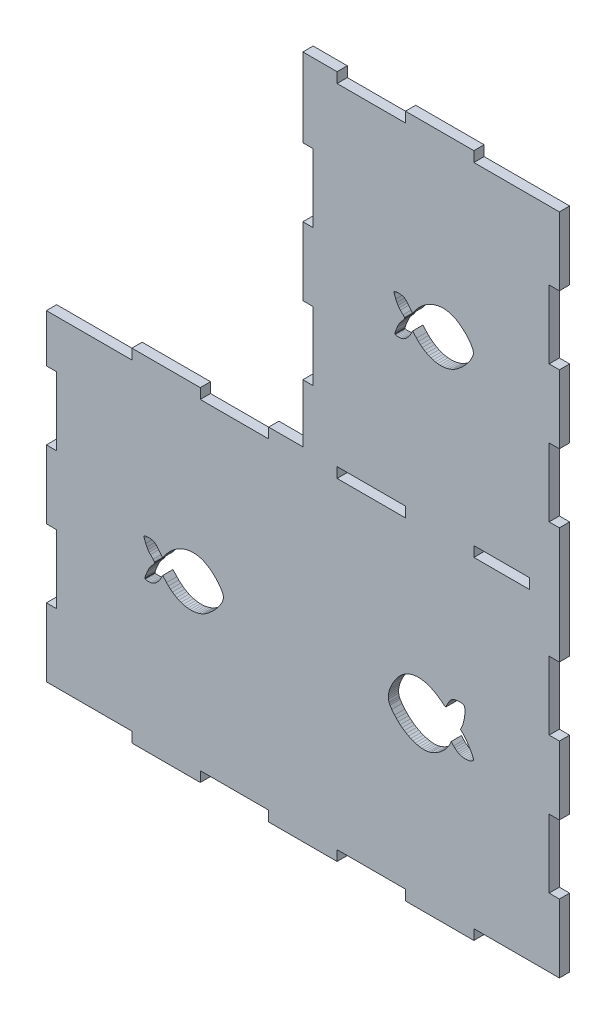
SolidWorks part; units mm, degrees
ref_plane "Alzado" through (0, 0, 0) normal (0, 0, 1) x (1, 0, 0)
ref_plane "Planta" through (0, 0, 0) normal (0, 1, 0) x (1, 0, 0)
ref_plane "Vista lateral" through (0, 0, 0) normal (1, 0, 0) x (0, 0, -1)
sketch "Sketch1" plane through (0, 0, 0) normal (0, 0, 1) x (1, 0, 0)
  line L1 (0, 0) -> (600, 0)
  line L2 (0, 0) -> (0, 400)
  line L3 (0, 400) -> (300, 400)
  line L4 (600, 0) -> (600, 400)
  line L6 (600, 400) -> (600, 800)
  line L7 (600, 800) -> (300, 800)
  line L8 (300, 400) -> (300, 800)
  dimension "D1" = 600
  dimension "D2" = 300
  dimension "D3" = 400
  dimension "D4" = 400
  dimension "D5" = 400
extrude "Boss-Extrude1" add sketch "Sketch1" along normal blind 12
sketch "Sketch2" plane through (0, 0, 12) normal (0, 0, 1) x (1, 0, 0)
  line L0 (0, 0) -> (600, 0) construction
  line L1 (0, 0) -> (100, 0)
  line L2 (0, 0) -> (0, 12)
  line L3 (0, 12) -> (100, 12)
  line L4 (100, 0) -> (100, 12)
  line L5 (180, 0) -> (260, 0)
  line L6 (180, 0) -> (180, 12)
  line L7 (180, 12) -> (260, 12)
  line L8 (260, 0) -> (260, 12)
  line L9 (0, 200) -> (600, 200) construction
  line L10 (340, 0) -> (420, 0)
  line L11 (340, 0) -> (340, 12)
  line L12 (340, 12) -> (420, 12)
  line L13 (420, 0) -> (420, 12)
  line L14 (500, 0) -> (600, 0)
  line L15 (500, 0) -> (500, 12)
  line L16 (500, 12) -> (600, 12)
  line L17 (600, 0) -> (600, 12)
  line L18 (0, 400) -> (0, 0) construction
  line L19 (600, 0) -> (600, 800) construction
  line L20 (260, 400) -> (260, 388)
  line L21 (180, 388) -> (260, 388)
  line L22 (180, 400) -> (180, 388)
  line L23 (180, 400) -> (260, 400)
  line L24 (100, 400) -> (100, 388)
  line L25 (0, 388) -> (100, 388)
  line L26 (0, 400) -> (0, 388)
  line L27 (0, 400) -> (100, 400)
  line L28 (300, 0) -> (300, 400) construction
  line L29 (0, 92) -> (12, 92)
  line L30 (0, 92) -> (0, 172)
  line L31 (0, 172) -> (12, 172)
  line L32 (12, 92) -> (12, 172)
  line L33 (0, 252) -> (12, 252)
  line L34 (0, 252) -> (0, 332)
  line L35 (0, 332) -> (12, 332)
  line L36 (12, 252) -> (12, 332)
  line L37 (588, 252) -> (588, 332)
  line L38 (600, 332) -> (588, 332)
  line L39 (600, 252) -> (600, 332)
  line L40 (600, 252) -> (588, 252)
  line L41 (588, 92) -> (588, 172)
  line L42 (600, 172) -> (588, 172)
  line L43 (600, 92) -> (600, 172)
  line L44 (600, 92) -> (588, 92)
  line L45 (300, 400) -> (600, 400) construction
  line L46 (600, 708) -> (588, 708)
  line L47 (600, 708) -> (600, 628)
  line L48 (600, 628) -> (588, 628)
  line L49 (588, 708) -> (588, 628)
  line L50 (600, 548) -> (588, 548)
  line L51 (600, 548) -> (600, 468)
  line L52 (600, 468) -> (588, 468)
  line L53 (588, 548) -> (588, 468)
  line L54 (600, 800) -> (600, 788)
  line L55 (500, 788) -> (600, 788)
  line L56 (500, 800) -> (500, 788)
  line L57 (500, 800) -> (600, 800)
  line L58 (420, 800) -> (420, 788)
  line L59 (340, 788) -> (420, 788)
  line L60 (340, 800) -> (340, 788)
  line L61 (340, 800) -> (420, 800)
  line L62 (450, 800) -> (450, 400) construction
  line L63 (600, 800) -> (300, 800) construction
  line L64 (312, 548) -> (312, 468)
  line L65 (300, 468) -> (312, 468)
  line L66 (300, 548) -> (300, 468)
  line L67 (300, 548) -> (312, 548)
  line L68 (312, 708) -> (312, 628)
  line L69 (300, 628) -> (312, 628)
  line L70 (300, 708) -> (300, 628)
  line L71 (300, 708) -> (312, 708)
extrude "Cut-Extrude1" cut sketch "Sketch2" against normal blind 12
sketch "Sketch3" plane through (0, 0, 0) normal (0, 0, 1) x (1, 0, 0)
  line L0 (497.3852, 180.3641) -> (495.939, 179.7208)
  line L1 (495.939, 179.7208) -> (494.1832, 179.2606)
  line L2 (494.1832, 179.2606) -> (492.2155, 178.9837)
  line L3 (492.2155, 178.9837) -> (490.1336, 178.8902)
  line L4 (490.1336, 178.8902) -> (488.0353, 178.9801)
  line L5 (488.0353, 178.9801) -> (486.0182, 179.2535)
  line L6 (486.0182, 179.2535) -> (484.1801, 179.7106)
  line L7 (484.1801, 179.7106) -> (482.6186, 180.3513)
  line L8 (482.6186, 180.3513) -> (481.0693, 181.2893)
  line L9 (481.0693, 181.2893) -> (479.3656, 182.5185)
  line L10 (479.3656, 182.5185) -> (477.7141, 183.8793)
  line L11 (477.7141, 183.8793) -> (476.3214, 185.2123)
  line L12 (476.3214, 185.2123) -> (473.4259, 188.2811)
  line L13 (473.4259, 188.2811) -> (471.9019, 184.8501)
  line L14 (471.9019, 184.8501) -> (471.051, 183.1347)
  line L15 (471.051, 183.1347) -> (470.0295, 181.4206)
  line L16 (470.0295, 181.4206) -> (467.5367, 178.0455)
  line L17 (467.5367, 178.0455) -> (464.5469, 174.824)
  line L18 (464.5469, 174.824) -> (461.1837, 171.855)
  line L19 (461.1837, 171.855) -> (457.5708, 169.2375)
  line L20 (457.5708, 169.2375) -> (453.8318, 167.0704)
  line L21 (453.8318, 167.0704) -> (450.0902, 165.4528)
  line L22 (450.0902, 165.4528) -> (448.2571, 164.8809)
  line L23 (448.2571, 164.8809) -> (446.4697, 164.4835)
  line L24 (446.4697, 164.4835) -> (444.0615, 164.1781)
  line L25 (444.0615, 164.1781) -> (441.5923, 164.0839)
  line L26 (441.5923, 164.0839) -> (439.0741, 164.1956)
  line L27 (439.0741, 164.1956) -> (436.5188, 164.508)
  line L28 (436.5188, 164.508) -> (433.9383, 165.0156)
  line L29 (433.9383, 165.0156) -> (431.3446, 165.7131)
  line L30 (431.3446, 165.7131) -> (428.7496, 166.5952)
  line L31 (428.7496, 166.5952) -> (426.1654, 167.6566)
  line L32 (426.1654, 167.6566) -> (423.6038, 168.8919)
  line L33 (423.6038, 168.8919) -> (421.0768, 170.2958)
  line L34 (421.0768, 170.2958) -> (418.5963, 171.863)
  line L35 (418.5963, 171.863) -> (416.1743, 173.5881)
  line L36 (416.1743, 173.5881) -> (413.8228, 175.4658)
  line L37 (413.8228, 175.4658) -> (411.5536, 177.4907)
  line L38 (411.5536, 177.4907) -> (409.3788, 179.6576)
  line L39 (409.3788, 179.6576) -> (407.3103, 181.9611)
  line L40 (407.3103, 181.9611) -> (403.9951, 186.0364)
  line L41 (403.9951, 186.0364) -> (401.8776, 189.1484)
  line L42 (401.8776, 189.1484) -> (401.175, 190.5041)
  line L43 (401.175, 190.5041) -> (400.6603, 191.812)
  line L44 (400.6603, 191.812) -> (400.046, 194.5421)
  line L45 (400.046, 194.5421) -> (399.9135, 196.4474)
  line L46 (399.9135, 196.4474) -> (400.0169, 198.509)
  line L47 (400.0169, 198.509) -> (400.3421, 200.7005)
  line L48 (400.3421, 200.7005) -> (400.8748, 202.9951)
  line L49 (400.8748, 202.9951) -> (401.601, 205.3663)
  line L50 (401.601, 205.3663) -> (402.5065, 207.7875)
  line L51 (402.5065, 207.7875) -> (404.7988, 212.6733)
  line L52 (404.7988, 212.6733) -> (407.6386, 217.4398)
  line L53 (407.6386, 217.4398) -> (410.9127, 221.8739)
  line L54 (410.9127, 221.8739) -> (412.6772, 223.8998)
  line L55 (412.6772, 223.8998) -> (414.5078, 225.7629)
  line L56 (414.5078, 225.7629) -> (416.3905, 227.4364)
  line L57 (416.3905, 227.4364) -> (418.3109, 228.8938)
  line L58 (418.3109, 228.8938) -> (420.5881, 230.3261)
  line L59 (420.5881, 230.3261) -> (422.9456, 231.5266)
  line L60 (422.9456, 231.5266) -> (425.377, 232.4958)
  line L61 (425.377, 232.4958) -> (427.8757, 233.2346)
  line L62 (427.8757, 233.2346) -> (430.4354, 233.7436)
  line L63 (430.4354, 233.7436) -> (433.0494, 234.0235)
  line L64 (433.0494, 234.0235) -> (435.7113, 234.075)
  line L65 (435.7113, 234.075) -> (438.4145, 233.8988)
  line L66 (438.4145, 233.8988) -> (441.1525, 233.4956)
  line L67 (441.1525, 233.4956) -> (443.9189, 232.8661)
  line L68 (443.9189, 232.8661) -> (446.7072, 232.0109)
  line L69 (446.7072, 232.0109) -> (449.5107, 230.9308)
  line L70 (449.5107, 230.9308) -> (452.3231, 229.6265)
  line L71 (452.3231, 229.6265) -> (455.1378, 228.0986)
  line L72 (455.1378, 228.0986) -> (457.9482, 226.3479)
  line L73 (457.9482, 226.3479) -> (460.748, 224.375)
  line L74 (460.748, 224.375) -> (466.9223, 219.7674)
  line L75 (466.9223, 219.7674) -> (469.5264, 224.8428)
  line L76 (469.5264, 224.8428) -> (470.9286, 227.3791)
  line L77 (470.9286, 227.3791) -> (472.2237, 229.2293)
  line L78 (472.2237, 229.2293) -> (473.5833, 230.6017)
  line L79 (473.5833, 230.6017) -> (475.1793, 231.7049)
  line L80 (475.1793, 231.7049) -> (476.7404, 232.4144)
  line L81 (476.7404, 232.4144) -> (478.6103, 232.9445)
  line L82 (478.6103, 232.9445) -> (480.6531, 233.291)
  line L83 (480.6531, 233.291) -> (482.7325, 233.4498)
  line L84 (482.7325, 233.4498) -> (484.7126, 233.4165)
  line L85 (484.7126, 233.4165) -> (486.4571, 233.1871)
  line L86 (486.4571, 233.1871) -> (487.8301, 232.7573)
  line L87 (487.8301, 232.7573) -> (488.6954, 232.1229)
  line L88 (488.6954, 232.1229) -> (489.0274, 231.5181)
  line L89 (489.0274, 231.5181) -> (489.2797, 230.6925)
  line L90 (489.2797, 230.6925) -> (489.5561, 228.4748)
  line L91 (489.5561, 228.4748) -> (489.5474, 225.6622)
  line L92 (489.5474, 225.6622) -> (489.2763, 222.4475)
  line L93 (489.2763, 222.4475) -> (488.7654, 219.0231)
  line L94 (488.7654, 219.0231) -> (488.0374, 215.5818)
  line L95 (488.0374, 215.5818) -> (487.115, 212.3162)
  line L96 (487.115, 212.3162) -> (486.021, 209.4188)
  line L97 (486.021, 209.4188) -> (484.437, 205.8395)
  line L98 (484.437, 205.8395) -> (486.5979, 203.857)
  line L99 (486.5979, 203.857) -> (488.5932, 201.7658)
  line L100 (488.5932, 201.7658) -> (490.7625, 199.0602)
  line L101 (490.7625, 199.0602) -> (492.9652, 195.9693)
  line L102 (492.9652, 195.9693) -> (495.0608, 192.722)
  line L103 (495.0608, 192.722) -> (496.9085, 189.5475)
  line L104 (496.9085, 189.5475) -> (498.3678, 186.6745)
  line L105 (498.3678, 186.6745) -> (499.2981, 184.3323)
  line L106 (499.2981, 184.3323) -> (499.5209, 183.4317)
  line L107 (499.5209, 183.4317) -> (499.5587, 182.7497)
  line L108 (499.5587, 182.7497) -> (499.3476, 182.1929)
  line L109 (499.3476, 182.1929) -> (498.8674, 181.5575)
  line L110 (498.8674, 181.5575) -> (497.3852, 180.3641)
extrude "Cut-Extrude3" cut sketch "Sketch3" along normal blind 12
sketch "Sketch5" plane through (0, 0, 0) normal (0, 0, 1) x (1, 0, 0)
  line L0 (410.2019, 576.0093) -> (411.6393, 579.1667)
  line L1 (411.6393, 579.1667) -> (412.9125, 581.57)
  line L2 (412.9125, 581.57) -> (414.1326, 583.4079)
  line L3 (414.1326, 583.4079) -> (415.4106, 584.8692)
  line L4 (415.4106, 584.8692) -> (417.3497, 586.9775)
  line L5 (417.3497, 586.9775) -> (418.6224, 588.6776)
  line L6 (418.6224, 588.6776) -> (419.0407, 589.6421)
  line L7 (419.0407, 589.6421) -> (418.9947, 590.1078)
  line L8 (418.9947, 590.1078) -> (418.7065, 590.6701)
  line L9 (418.7065, 590.6701) -> (417.1871, 592.4077)
  line L10 (417.1871, 592.4077) -> (414.0495, 595.5005)
  line L11 (414.0495, 595.5005) -> (412.5386, 597.1295)
  line L12 (412.5386, 597.1295) -> (411.2387, 598.9304)
  line L13 (411.2387, 598.9304) -> (409.992, 601.1528)
  line L14 (409.992, 601.1528) -> (408.6406, 604.0459)
  line L15 (408.6406, 604.0459) -> (406.9516, 608.2828)
  line L16 (406.9516, 608.2828) -> (406.5087, 609.7189)
  line L17 (406.5087, 609.7189) -> (406.4302, 610.4213)
  line L18 (406.4302, 610.4213) -> (406.872, 610.8406)
  line L19 (406.872, 610.8406) -> (407.704, 611.1863)
  line L20 (407.704, 611.1863) -> (410.1956, 611.6262)
  line L21 (410.1956, 611.6262) -> (413.2194, 611.6797)
  line L22 (413.2194, 611.6797) -> (416.0898, 611.2855)
  line L23 (416.0898, 611.2855) -> (418.048, 610.6659)
  line L24 (418.048, 610.6659) -> (419.6701, 609.6768)
  line L25 (419.6701, 609.6768) -> (421.4627, 607.9092)
  line L26 (421.4627, 607.9092) -> (423.9325, 604.954)
  line L27 (423.9325, 604.954) -> (428.3612, 599.4722)
  line L28 (428.3612, 599.4722) -> (431.0906, 603.2649)
  line L29 (431.0906, 603.2649) -> (433.5486, 606.4405)
  line L30 (433.5486, 606.4405) -> (436.15, 609.3459)
  line L31 (436.15, 609.3459) -> (438.879, 611.9761)
  line L32 (438.879, 611.9761) -> (441.7199, 614.3259)
  line L33 (441.7199, 614.3259) -> (444.657, 616.3902)
  line L34 (444.657, 616.3902) -> (447.6746, 618.164)
  line L35 (447.6746, 618.164) -> (450.757, 619.6421)
  line L36 (450.757, 619.6421) -> (453.8885, 620.8195)
  line L37 (453.8885, 620.8195) -> (457.0535, 621.6909)
  line L38 (457.0535, 621.6909) -> (460.2362, 622.2513)
  line L39 (460.2362, 622.2513) -> (463.421, 622.4957)
  line L40 (463.421, 622.4957) -> (466.592, 622.4188)
  line L41 (466.592, 622.4188) -> (469.7337, 622.0156)
  line L42 (469.7337, 622.0156) -> (472.8304, 621.281)
  line L43 (472.8304, 621.281) -> (475.8663, 620.2098)
  line L44 (475.8663, 620.2098) -> (478.8257, 618.797)
  line L45 (478.8257, 618.797) -> (482.7894, 616.3336)
  line L46 (482.7894, 616.3336) -> (486.6206, 613.3823)
  line L47 (486.6206, 613.3823) -> (490.1875, 610.1002)
  line L48 (490.1875, 610.1002) -> (493.358, 606.6449)
  line L49 (493.358, 606.6449) -> (496, 603.1735)
  line L50 (496, 603.1735) -> (497.9816, 599.8435)
  line L51 (497.9816, 599.8435) -> (498.6835, 598.2807)
  line L52 (498.6835, 598.2807) -> (499.1707, 596.8121)
  line L53 (499.1707, 596.8121) -> (499.4268, 595.4576)
  line L54 (499.4268, 595.4576) -> (499.4353, 594.2367)
  line L55 (499.4353, 594.2367) -> (499.1112, 592.5354)
  line L56 (499.1112, 592.5354) -> (498.4965, 590.6874)
  line L57 (498.4965, 590.6874) -> (497.6165, 588.7212)
  line L58 (497.6165, 588.7212) -> (496.4966, 586.6651)
  line L59 (496.4966, 586.6651) -> (493.6385, 582.3964)
  line L60 (493.6385, 582.3964) -> (490.1246, 578.1082)
  line L61 (490.1246, 578.1082) -> (486.1577, 574.0271)
  line L62 (486.1577, 574.0271) -> (481.9404, 570.3798)
  line L63 (481.9404, 570.3798) -> (479.8012, 568.7898)
  line L64 (479.8012, 568.7898) -> (477.6753, 567.3931)
  line L65 (477.6753, 567.3931) -> (475.5882, 566.2183)
  line L66 (475.5882, 566.2183) -> (473.5651, 565.2937)
  line L67 (473.5651, 565.2937) -> (470.9567, 564.3741)
  line L68 (470.9567, 564.3741) -> (468.3225, 563.6808)
  line L69 (468.3225, 563.6808) -> (465.6703, 563.2117)
  line L70 (465.6703, 563.2117) -> (463.0074, 562.9647)
  line L71 (463.0074, 562.9647) -> (460.3413, 562.9378)
  line L72 (460.3413, 562.9378) -> (457.6796, 563.1289)
  line L73 (457.6796, 563.1289) -> (455.0297, 563.5358)
  line L74 (455.0297, 563.5358) -> (452.3991, 564.1566)
  line L75 (452.3991, 564.1566) -> (449.7954, 564.9891)
  line L76 (449.7954, 564.9891) -> (447.2259, 566.0312)
  line L77 (447.2259, 566.0312) -> (444.6983, 567.281)
  line L78 (444.6983, 567.281) -> (442.2199, 568.7362)
  line L79 (442.2199, 568.7362) -> (439.7983, 570.3948)
  line L80 (439.7983, 570.3948) -> (437.441, 572.2548)
  line L81 (437.441, 572.2548) -> (435.1555, 574.314)
  line L82 (435.1555, 574.314) -> (432.9492, 576.5704)
  line L83 (432.9492, 576.5704) -> (428.3773, 581.5439)
  line L84 (428.3773, 581.5439) -> (427.0644, 578.815)
  line L85 (427.0644, 578.815) -> (425.1977, 575.6005)
  line L86 (425.1977, 575.6005) -> (422.8705, 572.593)
  line L87 (422.8705, 572.593) -> (420.349, 570.0945)
  line L88 (420.349, 570.0945) -> (419.0985, 569.1306)
  line L89 (419.0985, 569.1306) -> (417.8991, 568.4072)
  line L90 (417.8991, 568.4072) -> (416.4516, 567.8201)
  line L91 (416.4516, 567.8201) -> (414.8154, 567.3947)
  line L92 (414.8154, 567.3947) -> (413.1059, 567.1323)
  line L93 (413.1059, 567.1323) -> (411.4387, 567.034)
  line L94 (411.4387, 567.034) -> (409.9294, 567.1009)
  line L95 (409.9294, 567.1009) -> (408.6936, 567.3342)
  line L96 (408.6936, 567.3342) -> (407.8469, 567.735)
  line L97 (407.8469, 567.735) -> (407.5046, 568.3044)
  line L98 (407.5046, 568.3044) -> (407.6872, 569.2973)
  line L99 (407.6872, 569.2973) -> (408.2566, 571.0809)
  line L100 (408.2566, 571.0809) -> (410.2019, 576.0093)
extrude "Cut-Extrude5" cut sketch "Sketch5" along normal blind 12
sketch "Sketch6" plane through (0, 0, 0) normal (0, 0, 1) x (1, 0, 0)
  line L0 (117.877, 182.2313) -> (119.3143, 185.3888)
  line L1 (119.3143, 185.3888) -> (120.5876, 187.792)
  line L2 (120.5876, 187.792) -> (121.8077, 189.6299)
  line L3 (121.8077, 189.6299) -> (123.0857, 191.0912)
  line L4 (123.0857, 191.0912) -> (125.0248, 193.1996)
  line L5 (125.0248, 193.1996) -> (126.2975, 194.8996)
  line L6 (126.2975, 194.8996) -> (126.7158, 195.8641)
  line L7 (126.7158, 195.8641) -> (126.6698, 196.3298)
  line L8 (126.6698, 196.3298) -> (126.3816, 196.8922)
  line L9 (126.3816, 196.8922) -> (124.8622, 198.6297)
  line L10 (124.8622, 198.6297) -> (121.7246, 201.7226)
  line L11 (121.7246, 201.7226) -> (120.2137, 203.3515)
  line L12 (120.2137, 203.3515) -> (118.9138, 205.1525)
  line L13 (118.9138, 205.1525) -> (117.6671, 207.3748)
  line L14 (117.6671, 207.3748) -> (116.3157, 210.2679)
  line L15 (116.3157, 210.2679) -> (114.6267, 214.5048)
  line L16 (114.6267, 214.5048) -> (114.1838, 215.941)
  line L17 (114.1838, 215.941) -> (114.1052, 216.6433)
  line L18 (114.1052, 216.6433) -> (114.5471, 217.0626)
  line L19 (114.5471, 217.0626) -> (115.3791, 217.4083)
  line L20 (115.3791, 217.4083) -> (117.8707, 217.8483)
  line L21 (117.8707, 217.8483) -> (120.8945, 217.9018)
  line L22 (120.8945, 217.9018) -> (123.7649, 217.5076)
  line L23 (123.7649, 217.5076) -> (125.7231, 216.8879)
  line L24 (125.7231, 216.8879) -> (127.3452, 215.8988)
  line L25 (127.3452, 215.8988) -> (129.1377, 214.1312)
  line L26 (129.1377, 214.1312) -> (131.6076, 211.176)
  line L27 (131.6076, 211.176) -> (136.0363, 205.6943)
  line L28 (136.0363, 205.6943) -> (138.7657, 209.487)
  line L29 (138.7657, 209.487) -> (141.2237, 212.6625)
  line L30 (141.2237, 212.6625) -> (143.8251, 215.5679)
  line L31 (143.8251, 215.5679) -> (146.5541, 218.1981)
  line L32 (146.5541, 218.1981) -> (149.3949, 220.5479)
  line L33 (149.3949, 220.5479) -> (152.332, 222.6123)
  line L34 (152.332, 222.6123) -> (155.3496, 224.3861)
  line L35 (155.3496, 224.3861) -> (158.4321, 225.8642)
  line L36 (158.4321, 225.8642) -> (161.5636, 227.0415)
  line L37 (161.5636, 227.0415) -> (164.7286, 227.9129)
  line L38 (164.7286, 227.9129) -> (167.9113, 228.4734)
  line L39 (167.9113, 228.4734) -> (171.096, 228.7177)
  line L40 (171.096, 228.7177) -> (174.2671, 228.6408)
  line L41 (174.2671, 228.6408) -> (177.4088, 228.2376)
  line L42 (177.4088, 228.2376) -> (180.5055, 227.503)
  line L43 (180.5055, 227.503) -> (183.5414, 226.4318)
  line L44 (183.5414, 226.4318) -> (186.5008, 225.019)
  line L45 (186.5008, 225.019) -> (190.4644, 222.5557)
  line L46 (190.4644, 222.5557) -> (194.2957, 219.6043)
  line L47 (194.2957, 219.6043) -> (197.8626, 216.3223)
  line L48 (197.8626, 216.3223) -> (201.033, 212.8669)
  line L49 (201.033, 212.8669) -> (203.6751, 209.3956)
  line L50 (203.6751, 209.3956) -> (205.6567, 206.0655)
  line L51 (205.6567, 206.0655) -> (206.3585, 204.5027)
  line L52 (206.3585, 204.5027) -> (206.8458, 203.0342)
  line L53 (206.8458, 203.0342) -> (207.1019, 201.6796)
  line L54 (207.1019, 201.6796) -> (207.1104, 200.4588)
  line L55 (207.1104, 200.4588) -> (206.7863, 198.7574)
  line L56 (206.7863, 198.7574) -> (206.1716, 196.9095)
  line L57 (206.1716, 196.9095) -> (205.2916, 194.9432)
  line L58 (205.2916, 194.9432) -> (204.1717, 192.8871)
  line L59 (204.1717, 192.8871) -> (201.3136, 188.6185)
  line L60 (201.3136, 188.6185) -> (197.7997, 184.3302)
  line L61 (197.7997, 184.3302) -> (193.8328, 180.2491)
  line L62 (193.8328, 180.2491) -> (189.6155, 176.6019)
  line L63 (189.6155, 176.6019) -> (187.4762, 175.0118)
  line L64 (187.4762, 175.0118) -> (185.3504, 173.6152)
  line L65 (185.3504, 173.6152) -> (183.2633, 172.4404)
  line L66 (183.2633, 172.4404) -> (181.2402, 171.5157)
  line L67 (181.2402, 171.5157) -> (178.6317, 170.5961)
  line L68 (178.6317, 170.5961) -> (175.9976, 169.9028)
  line L69 (175.9976, 169.9028) -> (173.3454, 169.4337)
  line L70 (173.3454, 169.4337) -> (170.6825, 169.1868)
  line L71 (170.6825, 169.1868) -> (168.0164, 169.1598)
  line L72 (168.0164, 169.1598) -> (165.3547, 169.3509)
  line L73 (165.3547, 169.3509) -> (162.7048, 169.7579)
  line L74 (162.7048, 169.7579) -> (160.0742, 170.3786)
  line L75 (160.0742, 170.3786) -> (157.4704, 171.2111)
  line L76 (157.4704, 171.2111) -> (154.901, 172.2533)
  line L77 (154.901, 172.2533) -> (152.3733, 173.503)
  line L78 (152.3733, 173.503) -> (149.895, 174.9582)
  line L79 (149.895, 174.9582) -> (147.4734, 176.6168)
  line L80 (147.4734, 176.6168) -> (145.1161, 178.4768)
  line L81 (145.1161, 178.4768) -> (142.8306, 180.536)
  line L82 (142.8306, 180.536) -> (140.6243, 182.7924)
  line L83 (140.6243, 182.7924) -> (136.0524, 187.766)
  line L84 (136.0524, 187.766) -> (134.7395, 185.0371)
  line L85 (134.7395, 185.0371) -> (132.8727, 181.8226)
  line L86 (132.8727, 181.8226) -> (130.5456, 178.815)
  line L87 (130.5456, 178.815) -> (128.0241, 176.3166)
  line L88 (128.0241, 176.3166) -> (126.7735, 175.3526)
  line L89 (126.7735, 175.3526) -> (125.5742, 174.6292)
  line L90 (125.5742, 174.6292) -> (124.1267, 174.0421)
  line L91 (124.1267, 174.0421) -> (122.4904, 173.6168)
  line L92 (122.4904, 173.6168) -> (120.781, 173.3544)
  line L93 (120.781, 173.3544) -> (119.1138, 173.2561)
  line L94 (119.1138, 173.2561) -> (117.6045, 173.323)
  line L95 (117.6045, 173.323) -> (116.3687, 173.5562)
  line L96 (116.3687, 173.5562) -> (115.5219, 173.957)
  line L97 (115.5219, 173.957) -> (115.1797, 174.5265)
  line L98 (115.1797, 174.5265) -> (115.3623, 175.5193)
  line L99 (115.3623, 175.5193) -> (115.9317, 177.303)
  line L100 (115.9317, 177.303) -> (117.877, 182.2313)
extrude "Cut-Extrude6" cut sketch "Sketch6" along normal blind 12
sketch "Sketch7" plane through (0, 0, 12) normal (0, 0, 1) x (1, 0, 0)
  line L0 (300, 400) -> (260, 400) construction
  line L1 (340, 400) -> (420, 400)
  line L2 (340, 400) -> (340, 388)
  line L3 (340, 388) -> (420, 388)
  line L4 (420, 400) -> (420, 388)
  line L5 (500, 400) -> (565, 400)
  line L6 (500, 400) -> (500, 388)
  line L7 (500, 388) -> (565, 388)
  line L8 (565, 400) -> (565, 388)
  line L9 (300, 468) -> (300, 400) construction
extrude "Cut-Extrude7" cut sketch "Sketch7" against normal through all
equation "\"mat\"= 12mm"
equation "\"D1@Boss-Extrude1\"=\"mat\""
equation "\"D1@Sketch2\"=\"mat\""
equation "\"D2@Sketch2\"=\"mat\""
equation "\"D3@Sketch2\"=\"mat\""
equation "\"D4@Sketch2\"=\"mat\""
equation "\"sep\"= 80mm"
equation "\"D6@Sketch2\"=\"sep\""
equation "\"D7@Sketch2\"=\"sep\""
equation "\"D8@Sketch2\"=\"sep\""
equation "\"pes\"= 80mm"
equation "\"D9@Sketch2\"=\"pes\""
equation "\"D10@Sketch2\"=\"pes\""
equation "\"D12@Sketch2\"=\"mat\""
equation "\"D13@Sketch2\"=\"mat\""
equation "\"D14@Sketch2\"=\"pes\""
equation "\"D15@Sketch2\"=\"pes\""
equation "\"D16@Sketch2\"=\"sep\""
equation "\"D17@Sketch2\"=\"sep\""
equation "\"D1@Cut-Extrude1\"=\"mat\""
equation "\"D1@Cut-Extrude3\" = \"mat\""
equation "\"D1@Cut-Extrude5\"=\"mat\""
equation "\"D1@Cut-Extrude6\"=\"mat\""
equation "\"D1@Sketch7\"=\"mat\""
equation "\"D2@Sketch7\"=\"mat\""
equation "\"D3@Sketch7\"=\"pes\""
equation "\"D4@Sketch7\"=\"sep\""
